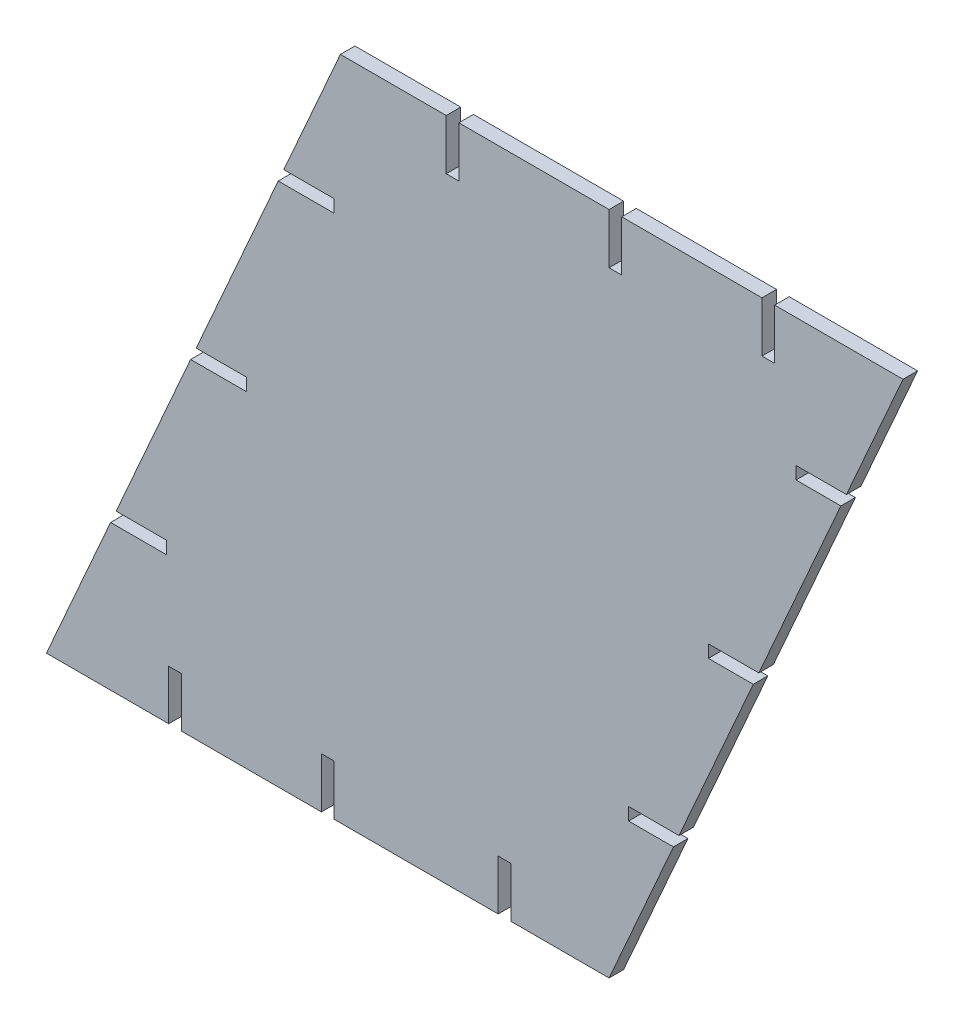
SolidWorks part; units mm, degrees
ref_plane "Front Plane" through (0, 0, 0) normal (0, 0, 1) x (1, 0, 0)
ref_plane "Top Plane" through (0, 0, 0) normal (0, 1, 0) x (1, 0, 0)
ref_plane "Right Plane" through (0, 0, 0) normal (1, 0, 0) x (0, 0, -1)
sketch "Sketch2" plane through (0, 0, 0) normal (0, 0, 1) x (1, 0, 0)
  line L0 (-145.1381, 30.6911) -> (-123.3245, 30.6911)
  line L1 (-145.1381, 30.6911) -> (-156.8036, 4.2816)
  line L2 (-29.1381, 30.6911) -> (-40.81, 4.2671)
  line L3 (-205.7463, -106.5191) -> (-180.5299, -106.5191)
  line L4 (-145.1381, 30.6911) -> (-123.3245, 30.6911)
  line L5 (-89.7456, 20.2911) -> (-87.1456, 20.2911)
  line L6 (-146.4456, -106.5191) -> (-112.6022, -106.5191)
  line L7 (-60.0157, -39.2124) -> (-75.3294, -73.8808)
  line L8 (-89.7456, 20.2911) -> (-89.7456, 30.6911)
  line L9 (-87.1456, 20.2911) -> (-87.1374, 30.6911)
  line L10 (-205.7463, -106.5191) -> (-180.5299, -106.5191)
  line L11 (-146.4456, -96.1191) -> (-149.0456, -96.1191)
  line L12 (-69.2673, -36.6124) -> (-69.2673, -39.2124)
  line L13 (-164.4673, -36.6124) -> (-164.4673, -39.2124)
  line L14 (-149.0456, -96.1191) -> (-149.0456, -106.5191)
  line L15 (-146.4456, -96.1191) -> (-146.4456, -106.5191)
  line L16 (-29.1381, 30.6911) -> (-40.81, 4.2671)
  line L17 (-87.1374, 30.6911) -> (-58.2215, 30.6911)
  line L18 (-176.0157, -39.2124) -> (-191.3674, -73.9669)
  line L19 (-157.9521, 1.6816) -> (-174.8673, -36.6124)
  line L20 (-69.2673, -36.6124) -> (-58.8673, -36.6124)
  line L21 (-69.2673, -39.2124) -> (-60.0157, -39.2124)
  line L22 (-180.9694, -73.9669) -> (-191.3694, -73.9669)
  line L23 (-180.9694, -76.5669) -> (-192.5178, -76.5669)
  line L24 (-146.4037, 4.2816) -> (-146.4037, 1.6816)
  line L25 (-164.4673, -36.6124) -> (-174.8673, -36.6124)
  line L26 (-164.4673, -39.2124) -> (-176.0157, -39.2124)
  line L27 (-146.4037, 4.2816) -> (-156.8037, 4.2816)
  line L28 (-146.4037, 1.6816) -> (-157.9521, 1.6816)
  line L29 (-192.5159, -76.5669) -> (-205.7463, -106.5191)
  line L30 (-85.7201, -73.8808) -> (-85.7201, -76.4808)
  line L31 (-85.7201, -73.8808) -> (-75.3201, -73.8808)
  line L32 (-85.7201, -76.4808) -> (-76.4686, -76.4808)
  line L33 (-123.3245, 20.2917) -> (-120.7245, 20.2917)
  line L34 (-51.2039, 4.2671) -> (-51.2039, 1.6671)
  line L35 (-51.2039, 4.2671) -> (-40.8039, 4.2671)
  line L36 (-51.2039, 1.6671) -> (-41.9523, 1.6671)
  line L37 (-123.3245, 20.2917) -> (-123.3245, 30.6917)
  line L38 (-120.7245, 20.2917) -> (-120.7163, 30.6917)
  line L39 (-58.2215, 20.2912) -> (-55.6215, 20.2912)
  line L40 (-58.2215, 20.2912) -> (-58.2215, 30.6912)
  line L41 (-55.6215, 20.2912) -> (-55.6133, 30.6912)
  line L42 (-177.9299, -96.2435) -> (-180.5299, -96.2435)
  line L43 (-180.5299, -96.2435) -> (-180.5299, -106.6435)
  line L44 (-177.9299, -96.2435) -> (-177.9299, -106.6435)
  line L45 (-110.0022, -96.174) -> (-112.6022, -96.174)
  line L46 (-112.6022, -96.174) -> (-112.6022, -106.574)
  line L47 (-110.0022, -96.174) -> (-110.0022, -106.574)
  line L48 (-177.9299, -106.5191) -> (-149.0456, -106.5191)
  line L49 (-177.9299, -106.5191) -> (-149.0456, -106.5191)
  line L50 (-110.0022, -106.5191) -> (-89.7463, -106.5191)
  line L51 (-55.6133, 30.6911) -> (-29.1381, 30.6911)
  line L52 (-120.7163, 30.6911) -> (-89.7456, 30.6911)
  line L53 (-120.7163, 30.6911) -> (-89.7456, 30.6911)
  line L54 (-41.9585, 1.6671) -> (-58.8673, -36.6124)
  line L55 (-41.9585, 1.6671) -> (-58.8673, -36.6124)
  line L56 (-76.4778, -76.4808) -> (-89.7463, -106.5191)
  line L57 (-180.9694, -73.9669) -> (-180.9694, -76.5669)
  point P35 (-85.7201, -75.1808)
  point P40 (-51.2039, 2.9671)
extrude "Boss-Extrude2" add sketch "Sketch2" along normal blind 3 contours L22 L57 L23 L29 L3 L43 L42 L44 L48 L14 L11 L15 L6 L46 L45 L47 L50 L56 L32 L30 L31 L7 L21 L12 L20 L54 L36 L34 L35 L2 L51 L41 L39 L40 L17 L9 L5 L8 L52 L38 L33 L37 L0 L1 L27 L24 L28 L19 L25 L13 L26
equation "\"t\"=2.6"
equation "\"D3@Sketch2\"=\"t\""
equation "\"D4@Sketch2\"=\"t\"*4"
